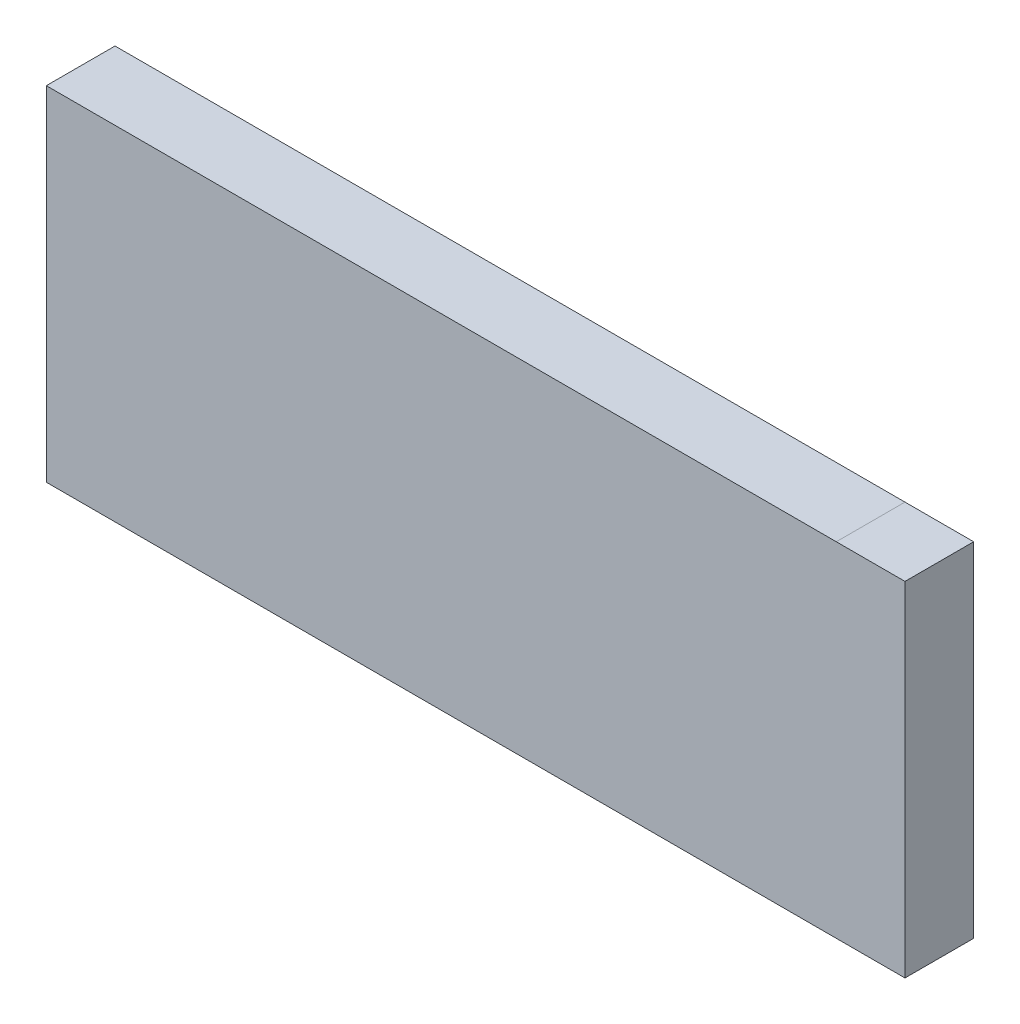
SolidWorks part; units mm, degrees
ref_plane "Ebene vorne" through (0, 0, 0) normal (0, 0, 1) x (1, 0, 0)
ref_plane "Ebene oben" through (0, 0, 0) normal (0, 1, 0) x (1, 0, 0)
ref_plane "Ebene rechts" through (0, 0, 0) normal (1, 0, 0) x (0, 0, -1)
sketch "Skizze1" plane through (0, 0, 0) normal (0, 0, 1) x (1, 0, 0)
  line L0 (0, -50) -> (0, 50)
  line L1 (0, 50) -> (250, 50)
  line L2 (250, 50) -> (250, -50)
  line L3 (250, -50) -> (0, -50)
  line L4 (0, 0) -> (152.2885, 0) construction
  dimension "D1" = 100
  dimension "D2" = 250
extrude "Aufsatz-Linear austragen1" add sketch "Skizze1" along normal blind 20
sketch "Skizze2" plane through (0, 50, 0) normal (0, 1, 0) x (1, 0, 0)
  line L0 (230, -20) -> (230, 0)
  line L1 (250, -20) -> (0, -20) construction
  line L2 (250, 0) -> (0, 0) construction
  line L3 (250, -20) -> (250, 0) construction
  dimension "D1" = 20
